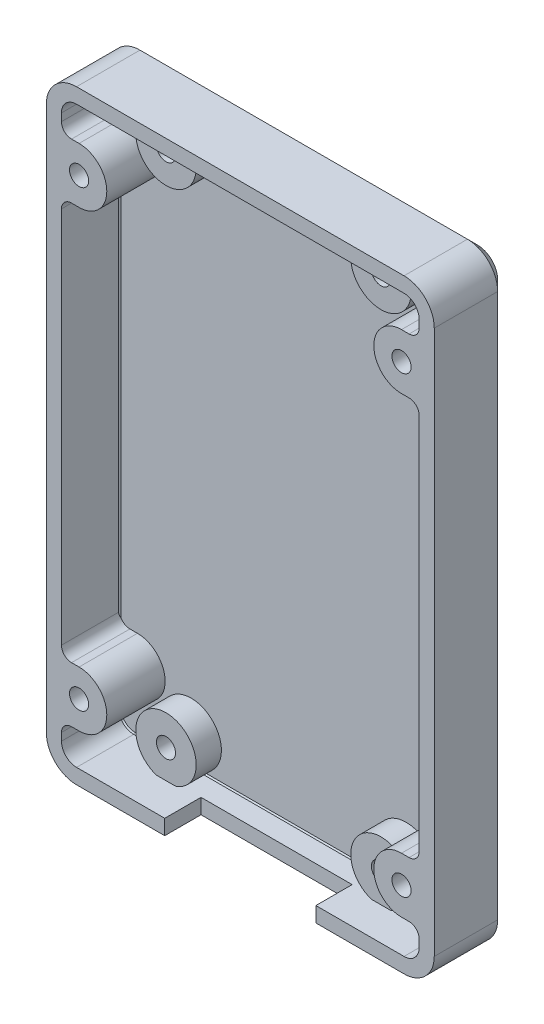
SolidWorks part; units mm, degrees
ref_plane "Front Plane" through (0, 0, 0) normal (0, 0, 1) x (1, 0, 0)
ref_plane "Top Plane" through (0, 0, 0) normal (0, 1, 0) x (1, 0, 0)
ref_plane "Right Plane" through (0, 0, 0) normal (1, 0, 0) x (0, 0, -1)
body saved out of another part "Stock-Enclosure^Shadowfang_Enclosure_V1-1"
fillet "Fillet1" radius 1 8 edges at (-17.965, 25.2787, 0.4568) (-17.965, 19.7787, 0.4568) (17.535, 25.2787, 0.4568) (17.535, 19.7787, 0.4568) (-17.965, -25.2213, 0.4568) (-17.965, -19.7213, 0.4568) (17.535, -25.2213, 0.4568) (17.535, -19.7213, 0.4568)
